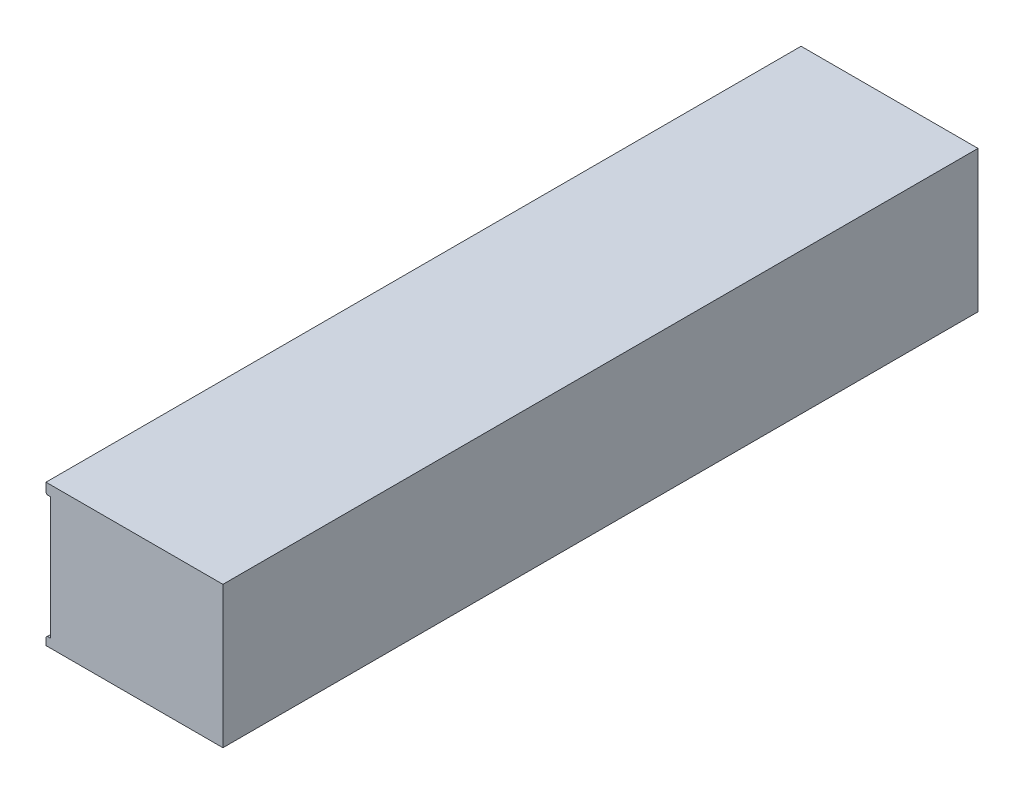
SolidWorks part; units mm, degrees
ref_plane "FRONT" through (0, 0, 0) normal (0, 0, 1) x (1, 0, 0)
ref_plane "TOP" through (0, 0, 0) normal (0, 1, 0) x (1, 0, 0)
ref_plane "RIGHT" through (0, 0, 0) normal (1, 0, 0) x (0, 0, -1)
sketch "Sketch1" plane through (0, 0, 0) normal (0, 0, 1) x (1, 0, 0)
  line L0 (50.673, 0) -> (50.673, -41.656)
  line L1 (50.673, -41.656) -> (-1.397, -41.656)
  line L2 (-1.397, -41.656) -> (-1.397, -39.116)
  line L3 (-1.397, -39.116) -> (0, -39.116)
  line L4 (0, -39.116) -> (0, -3.048)
  line L5 (0, -3.048) -> (-1.397, -3.048)
  line L6 (-1.397, -3.048) -> (-1.397, 0)
  line L7 (-1.397, 0) -> (50.673, 0)
  dimension "D1" = 52.07
  dimension "D2" = 50.673
  dimension "D3" = 3.048
  dimension "D4" = 2.54
  dimension "D5" = 41.656
extrude "Extrude1" add sketch "Sketch1" along normal mid plane 222.2246
sketch "Sketch2" plane through (0, 0, 0) normal (-1, 0, 0) x (0, 0, 1)
  line L1 (0, 0) -> (0, -41.656) construction
  line L2 (111.1123, -41.656) -> (-111.1123, -41.656) construction
  line L3 (0, -20.828) -> (26.0126, -20.828) construction
  point P0 (-106.2482, -6.35)
  point P1 (106.2482, -6.35)
  point P2 (4.8768, -6.35)
  point P4 (-4.8768, -6.35)
  point P9 (-4.8768, -35.814)
  point P12 (4.8768, -35.814)
  point P13 (106.2482, -35.814)
  point P14 (50.673, -6.35)
  point P15 (60.4266, -6.35)
  point P16 (-50.673, -35.814)
  point P17 (-60.4266, -6.35)
  point P18 (-106.2482, -35.814)
  point P19 (-50.673, -6.35)
  point P20 (-60.4266, -35.814)
  point P21 (50.673, -35.814)
  point P22 (60.4266, -35.814)
  dimension "D1" = 106.2482
  dimension "D2" = 60.4266
  dimension "D3" = 4.8768
  dimension "D4" = 14.478
  dimension "D5" = 14.986
  dimension "D6" = 50.673
hole_wizard "#10-32 Tapped Hole1" positions "3DSketch1" profile "Sketch3" tap size "#10-32" standard "Ansi Inch"
sketch3d "3DSketch1"
  point P0 (0, -6.35, -106.2482)
  point P3 (0, -6.35, 106.2482)
  point P6 (0, -6.35, 4.8768)
  point P9 (0, -6.35, -4.8768)
  point P12 (0, -35.814, -106.2482)
  point P15 (0, -35.814, -4.8768)
  point P18 (0, -35.814, 4.8768)
  point P21 (0, -35.814, 106.2482)
  point P24 (0, -6.35, -60.4266)
  point P27 (0, -6.35, -50.673)
  point P30 (0, -35.814, -50.673)
  point P33 (0, -35.814, -60.4266)
  point P36 (0, -6.35, 50.673)
  point P39 (0, -6.35, 60.4266)
  point P42 (0, -35.814, 60.4266)
  point P45 (0, -35.814, 50.673)
sketch "Sketch3" plane through (0, -6.35, -106.2482) normal (0, 1, 0) x (0, 0, 1)
  line L0 (0, 0) -> (0, 11.2108)
  line L1 (0, 11.2108) -> (2.0193, 9.9974)
  line L2 (2.0193, 9.9974) -> (2.0193, 7.62)
  line L3 (2.0193, 7.62) -> (2.413, 7.62)
  line L4 (2.413, 7.62) -> (2.413, 0)
  line L5 (2.413, 0) -> (0, 0)
  line L10 (0, 11.2108) -> (-2.0193, 9.9974) construction
  line L11 (0, -6.35) -> (0, 107.95) construction
  dimension "Tap Drill Dia." = 4.0386
  dimension "Tap Drill Depth" = 9.9974
  dimension "Thread Major Dia." = 4.826
  dimension "Thread Depth" = 7.62
  dimension "Drill Angle" = 118
chamfer "Chamfer1" distance 0.381 angle 45 2 edges at (-1.397, -39.116, 0) (-1.397, -3.048, 0)
